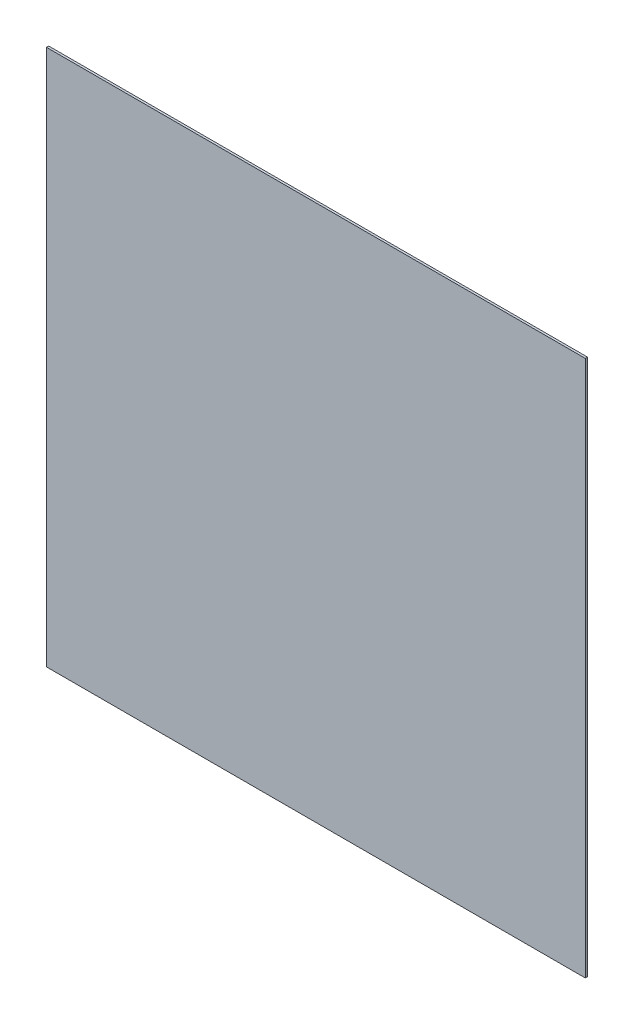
SolidWorks part; units mm, degrees
ref_plane "Front Plane" through (0, 0, 0) normal (0, 0, 1) x (1, 0, 0)
ref_plane "Top Plane" through (0, 0, 0) normal (0, 1, 0) x (1, 0, 0)
ref_plane "Right Plane" through (0, 0, 0) normal (1, 0, 0) x (0, 0, -1)
sketch "Sketch1" plane through (0, 0, 0) normal (0, 0, 1) x (1, 0, 0)
  line L1 (2.54, -2.54) -> (-612.14, -2.54)
  line L2 (2.54, -2.54) -> (2.54, 609.6)
  line L3 (2.54, 609.6) -> (-612.14, 609.6)
  line L4 (-612.14, -2.54) -> (-612.14, 609.6)
extrude "Extrude1" add sketch "Sketch1" along normal blind 2.54
